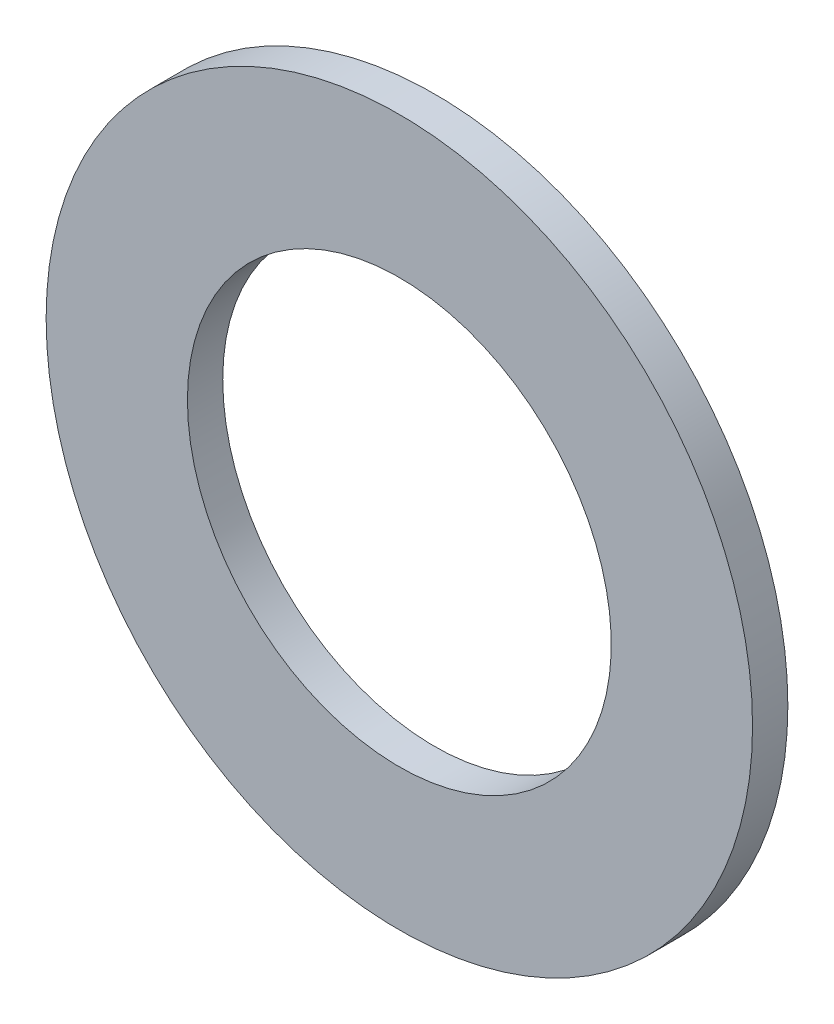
SolidWorks part; units mm, degrees
ref_plane "Front" through (0, 0, 0) normal (0, 0, 1) x (1, 0, 0)
ref_plane "Top" through (0, 0, 0) normal (0, 1, 0) x (1, 0, 0)
ref_plane "Right" through (0, 0, 0) normal (1, 0, 0) x (0, 0, -1)
sketch "Sketch1" plane through (0, 0, 0) normal (0, 0, 1) x (1, 0, 0)
  circle A0 centre (0, 0) radius 2.5
  circle A1 centre (0, 0) radius 1.5
  dimension "D1" = 5
  dimension "D2" = 3
extrude "Base-Extrude" add sketch "Sketch1" along normal blind 0.25
